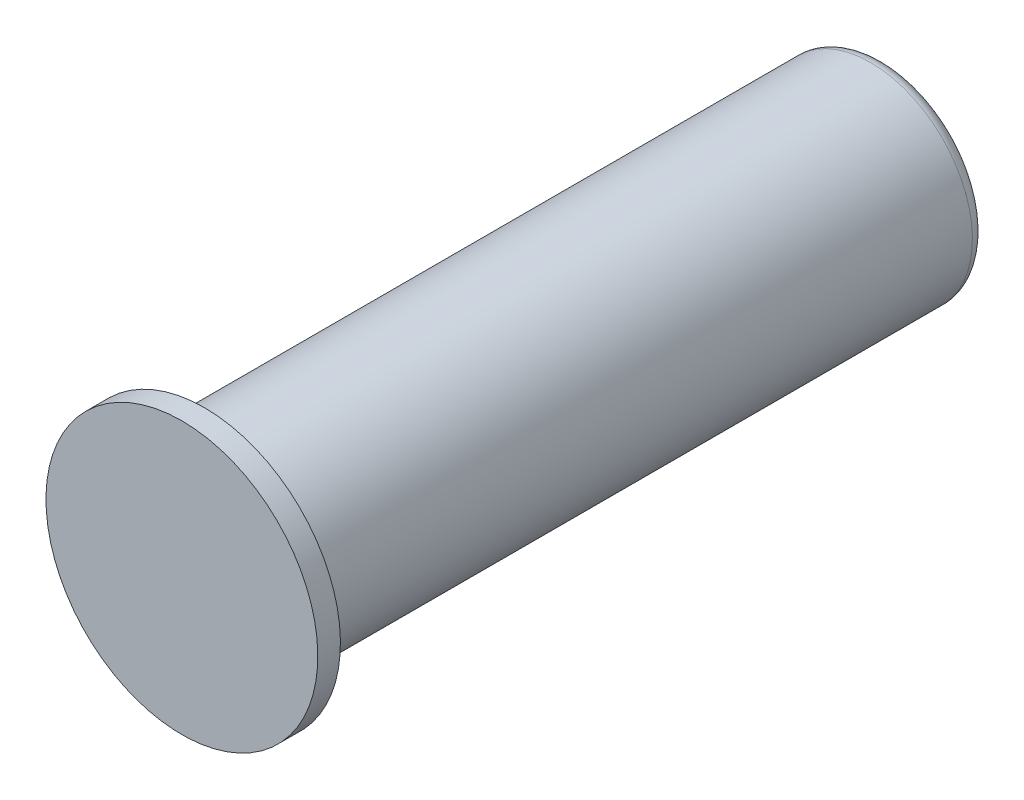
SolidWorks part; units mm, degrees
ref_plane "Front Plane" through (0, 0, 0) normal (0, 0, 1) x (1, 0, 0)
ref_plane "Top Plane" through (0, 0, 0) normal (0, 1, 0) x (1, 0, 0)
ref_plane "Right Plane" through (0, 0, 0) normal (1, 0, 0) x (0, 0, -1)
sketch "Sketch1" plane through (0, 0, 0) normal (1, 0, 0) x (0, 0, -1)
  line L0 (0, 0) -> (0, 30)
  line L1 (0, 30) -> (5, 30)
  line L2 (5, 30) -> (5, 22.5)
  line L3 (5, 22.5) -> (152, 22.5)
  line L4 (155, 19.5) -> (155, 4.5)
  line L5 (143.6906, 0) -> (0, 0)
  line L6 (154.5, 4) -> (146, 4)
  line L7 (154.5, 4) -> (155, 4.5)
  line L8 (146, 4) -> (143.6906, 0)
  arc A0 (152, 22.5) -> (155, 19.5) centre (152, 19.5) cw
  dimension "D2" = 3
  dimension "D1" = 30
  dimension "D3" = 5
  dimension "D4" = 150
  dimension "D5" = 22.5
  dimension "D6" = 4
  dimension "D7" = 0.5
  dimension "D8" = 45
  dimension "D9" = 60
  dimension "D10" = 9
revolve "Revolve1" add sketch "Sketch1" angle 360 about L5
